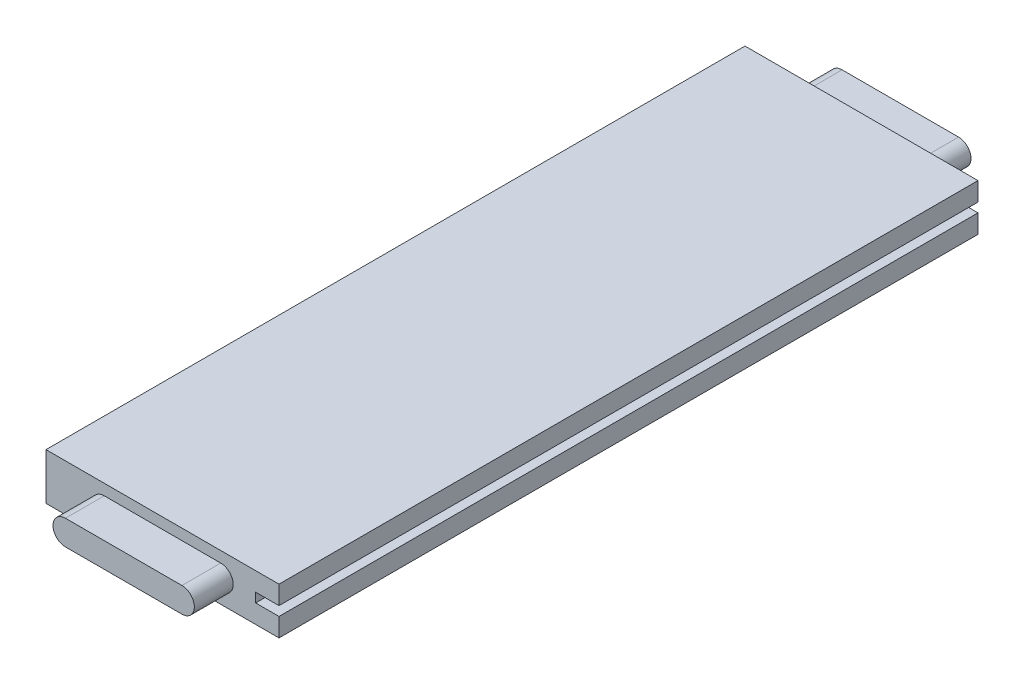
SolidWorks part; units mm, degrees
ref_plane "Alzado" through (0, 0, 0) normal (0, 0, 1) x (1, 0, 0)
ref_plane "Planta" through (0, 0, 0) normal (0, 1, 0) x (1, 0, 0)
ref_plane "Vista lateral" through (0, 0, 0) normal (1, 0, 0) x (0, 0, -1)
sketch "Croquis1" plane through (0, 0, 0) normal (0, 0, 1) x (1, 0, 0)
  line L0 (85, 17.5) -> (-85, -17.5) construction
  line L1 (-85, 17.5) -> (85, 17.5)
  line L2 (-85, 17.5) -> (-85, -17.5)
  line L3 (-85, -17.5) -> (85, -17.5)
  line L4 (85, 17.5) -> (85, -17.5)
extrude "Extruir1" add sketch "Croquis1" along normal mid plane 550
sketch "Croquis2" plane through (0, 0, 0) normal (0, 0, 1) x (1, 0, 0)
  line L0 (85, -17.5) -> (85, 17.5) construction
  line L1 (-85, 17.5) -> (85, 17.5)
  line L2 (-85, 17.5) -> (-85, 10)
  line L3 (-75, 15) -> (75, 15)
  line L4 (85, 17.5) -> (85, 10)
  line L5 (-85, 17.5) -> (-85, -17.5) construction
  line L6 (85, -17.5) -> (-85, -17.5)
  line L7 (85, -17.5) -> (85, -10)
  line L8 (75, -15) -> (-75, -15)
  line L9 (-85, -17.5) -> (-85, -10)
  line L10 (0, 0) -> (-85.2733, 0) construction
  line L11 (0, 0) -> (0, 19.2981) construction
  line L13 (-85, 10) -> (-85, -10)
  line L15 (-75, 15) -> (-75, -15)
  line L16 (75, 15) -> (75, -15)
  line L18 (85, 10) -> (85, -10)
  dimension "D1" = 30
  dimension "D2" = 150
extrude "Cepillado -Regruesado" cut sketch "Croquis2" against normal through all and the other way through all
sketch "Croquis3" plane through (0, 15, 0) normal (0, 1, 0) x (1, 0, 0)
  line L0 (75, 275) -> (-75, 275) construction
  line L1 (-75, 275) -> (75, 275)
  line L2 (-75, 275) -> (-75, 250)
  line L3 (-75, 250) -> (75, 250)
  line L4 (75, 275) -> (75, 250)
  line L5 (-75, 275) -> (-75, -275) construction
  line L6 (75, 275) -> (75, -275) construction
  line L7 (0, 0) -> (299.0225, 0) construction
  line L8 (75, -275) -> (-75, -275)
  line L9 (75, -275) -> (75, -250)
  line L10 (75, -250) -> (-75, -250)
  line L11 (-75, -275) -> (-75, -250)
  dimension "D1" = 500
extrude "Largo - Corte" cut sketch "Croquis3" against normal through all
sketch "Croquis5" plane through (0, 0, -250) normal (0, 0, -1) x (-1, 0, 0)
  line L0 (75, -15) -> (75, 15) construction
  line L1 (-60, -3) -> (-75, -3)
  line L2 (-60, -3) -> (-60, 3)
  line L3 (-60, 3) -> (-75, 3)
  line L4 (-75, -3) -> (-75, 3)
  line L5 (75, 0) -> (-75, 0) construction
  line L6 (-75, -15) -> (-75, 15) construction
  dimension "D1" = 15
  dimension "D2" = 6
extrude "Ranurado - Tupí" cut sketch "Croquis5" against normal through all
sketch "Croquis4" plane through (0, 0, 250) normal (0, 0, 1) x (1, 0, 0)
  line L0 (-37.5, 0) -> (37.5, 0) construction
  line L1 (-37.5, 8) -> (37.5, 8)
  line L2 (-37.5, -8) -> (37.5, -8)
  line L7 (75, 15) -> (-75, 15)
  line L8 (-75, 15) -> (-75, -15)
  line L9 (-75, -15) -> (75, -15)
  line L10 (75, -15) -> (75, -3)
  line L11 (75, 15) -> (-75, 15)
  line L12 (-75, 15) -> (-75, -15)
  line L13 (-75, -15) -> (75, -15)
  line L14 (75, -15) -> (75, -3)
  line L19 (60, -3) -> (60, 3)
  line L20 (60, -3) -> (60, 3)
  line L21 (75, -3) -> (60, -3)
  line L22 (75, -3) -> (60, -3)
  line L23 (75, 3) -> (75, 15)
  line L24 (75, 3) -> (75, 15)
  line L25 (60, 3) -> (75, 3)
  line L26 (60, 3) -> (75, 3)
  arc A0 (-37.5, 8) -> (-37.5, -8) centre (-37.5, 0) ccw
  arc A1 (37.5, -8) -> (37.5, 8) centre (37.5, 0) ccw
  point P3 (0, 0)
  dimension "D2" = 8
  dimension "D1" = 75
  dimension "D3" = 0
extrude "Espiga" cut sketch "Croquis4" against normal blind 25
mirror "Simetría1" about plane through (0, 0, 0) normal (0, 0, 1) of "Espiga"
